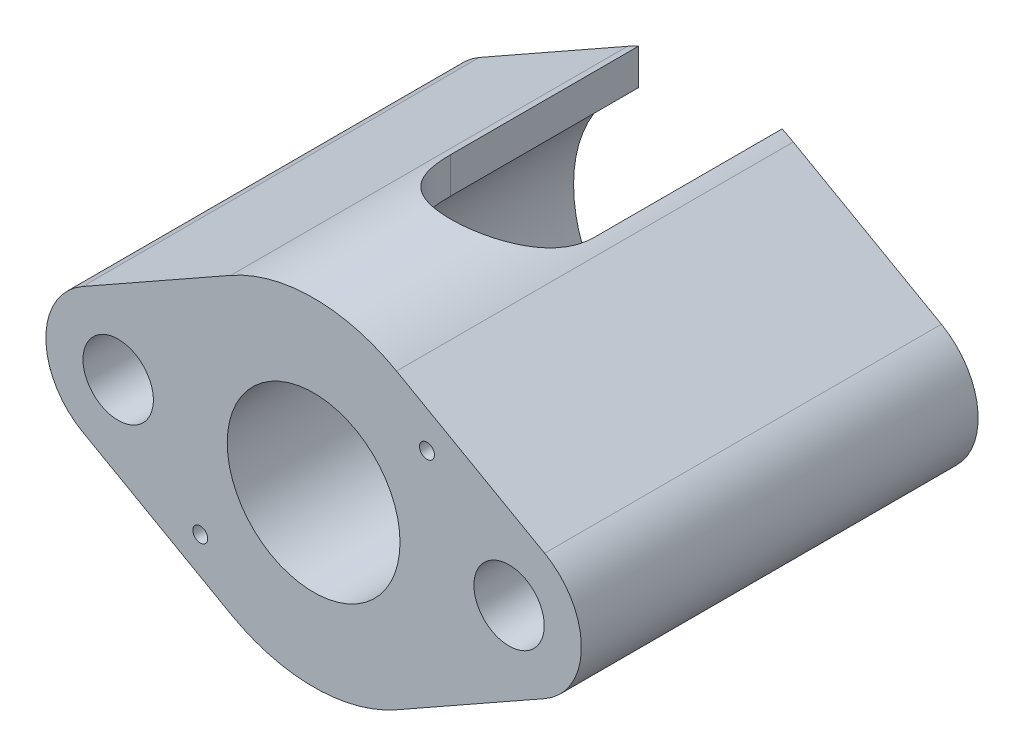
SolidWorks part; units mm, degrees
ref_plane "Front Plane" through (0, 0, 0) normal (0, 0, 1) x (1, 0, 0)
ref_plane "Top Plane" through (0, 0, 0) normal (0, 1, 0) x (1, 0, 0)
ref_plane "Right Plane" through (0, 0, 0) normal (1, 0, 0) x (0, 0, -1)
sketch "Sketch1" plane through (0, 0, 0) normal (0, 0, 1) x (1, 0, 0)
  line L0 (0, 10.9474) -> (0, -38.8709) construction
  line L1 (5.3861, 9.5308) -> (15.0119, 4.0909)
  line L2 (-5.3861, 9.5308) -> (-15.0119, 4.0909)
  line L3 (0, 0) -> (17.399, 0) construction
  line L4 (5.3861, -9.5308) -> (15.0119, -4.0909)
  line L5 (-5.3861, -9.5308) -> (-15.0119, -4.0909)
  arc A0 (5.3861, 9.5308) -> (-5.3861, 9.5308) centre (0, 0) ccw
  arc A1 (15.0119, -4.0909) -> (15.0119, 4.0909) centre (12.7, 0) ccw
  circle A2 centre (12.7, 0) radius 2.286
  circle A3 centre (0, 0) radius 5.6134
  arc A4 (-15.0119, -4.0909) -> (-15.0119, 4.0909) centre (-12.7, 0) cw
  arc A5 (5.3861, -9.5308) -> (-5.3861, -9.5308) centre (0, 0) cw
  circle A6 centre (-12.7, 0) radius 2.286
  dimension "D1" = 4.572
  dimension "D2" = 25.4
  dimension "D3" = 21.8948
  dimension "D5" = 11.2268
  dimension "D4" = 34.798
extrude "Boss-Extrude1" add sketch "Sketch1" along normal blind 25.781
sketch "Sketch2" plane through (0, 0, 0) normal (0, 0, -1) x (-1, 0, 0)
  circle A0 centre (0, 0) radius 8.89
  dimension "D1" = 17.78
extrude "Cut-Extrude1" cut sketch "Sketch2" against normal blind 17.2466
sketch "Sketch3" plane through (0, 0, 0) normal (0, 1, 0) x (1, 0, 0)
  line L0 (0, 0) -> (0, -12.2301) construction
  line L1 (0, 0) -> (4.6609, 0)
  line L2 (4.6609, 0) -> (4.6609, -12.2301)
  line L3 (0, -16.891) -> (0, -12.2301) construction
  line L4 (-4.6609, -12.2301) -> (-4.6609, 0)
  line L5 (-4.6609, 0) -> (0, 0)
  arc A0 (-4.6609, -12.2301) -> (4.6609, -12.2301) centre (0, -12.2301) ccw
  dimension "D1" = 4.6609
  dimension "D2" = 16.891
extrude "Cut-Extrude2" cut sketch "Sketch3" against normal through all and the other way through all
sketch "Sketch4" plane through (0, 0, 25.781) normal (0, 0, 1) x (1, 0, 0)
  line L0 (-11.43, -9.3596) -> (-11.43, -4.5241)
  line L1 (11.43, -9.3596) -> (11.43, -4.5241)
  line L2 (0, 0) -> (-18.5067, 0) construction
  line L3 (0, 0) -> (0, 11.4911) construction
  line L4 (-11.43, 4.5241) -> (-11.43, 9.3596)
  line L5 (11.43, 4.5241) -> (11.43, 9.3596)
  arc A0 (-11.43, -4.5241) -> (-11.43, 4.5241) centre (-12.7, 0) ccw
  arc A1 (-11.43, 9.3596) -> (-11.43, -9.3596) centre (-12.7, 0) ccw
  arc A2 (-15.0119, 4.0909) -> (-15.0119, -4.0909) centre (-12.7, 0) ccw construction
  arc A3 (11.43, 9.3596) -> (11.43, -9.3596) centre (12.7, 0) cw
  arc A4 (11.43, -4.5241) -> (11.43, 4.5241) centre (12.7, 0) cw
  dimension "D1" = 22.86
extrude "Cut-Extrude3" [suppressed] cut sketch "Sketch4" against normal offset from surface (20.701 mm away) 5.08
hole_wizard "CSK for #8 Flat Head Machine Screw1" positions "Sketch6" profile "Sketch5" countersink size "#8" standard "ANSI Inch"
sketch "Sketch6" [suppressed] plane through (0, 0, 5.08) normal (0, 0, 1) x (1, 0, 0)
  point P0 (-12.7, 0)
  point P3 (12.7, 0)
sketch "Sketch5" plane through (-12.7, 0, 5.08) normal (1, 0, 0) x (0, -1, 0)
  line L0 (0, 0) -> (0, 5.08)
  line L1 (0, 5.08) -> (2.1526, 5.08)
  line L2 (2.1526, 5.08) -> (2.1526, 2.3741)
  line L3 (2.1526, 2.3741) -> (4.2164, 0)
  line L5 (4.2164, 0) -> (0, 0)
  line L6 (-2.1526, 2.3741) -> (-4.2164, 0) construction
  line L11 (0, -6.35) -> (0, 107.95) construction
  dimension "Thru Hole Dia." = 4.3053
  dimension "Thru Hole Depth" = 5.08
  dimension "Near C'Sink Dia." = 8.4328
  dimension "Near C'Sink Angle" = 82
sketch "Sketch7" plane through (0, 0, 25.781) normal (0, 0, 1) x (1, 0, 0)
  line L0 (15.24, 6.9904) -> (15.24, -6.9904)
  line L1 (0, 0) -> (0, 13.5376) construction
  line L2 (-15.24, 6.9904) -> (-15.24, -6.9904)
  arc A0 (15.24, -6.9904) -> (15.24, 6.9904) centre (12.7, 0) ccw
  circle A1 centre (12.7, 0) radius 2.286 construction
  arc A2 (-15.24, -6.9904) -> (-15.24, 6.9904) centre (-12.7, 0) cw
  dimension "D1" = 30.48
extrude "Cut-Extrude4" [suppressed] cut sketch "Sketch7" against normal through all
sketch "Sketch8" plane through (0, 0, 25.781) normal (0, 0, 1) x (1, 0, 0)
  line L0 (7.366, 6.0388) -> (-7.366, -6.0388) construction
  line L1 (0, 0) -> (0, 6.0388) construction
  line L2 (0, 6.0388) -> (7.366, 6.0388) construction
  circle A0 centre (7.366, 6.0388) radius 0.4826
  circle A1 centre (-7.366, -6.0388) radius 0.4826
  point P4 (0, 0)
  dimension "D1" = 0.9652
  dimension "D2" = 19.05
  dimension "D3" = 7.366
extrude "Cut-Extrude5" cut sketch "Sketch8" against normal blind 6.35
